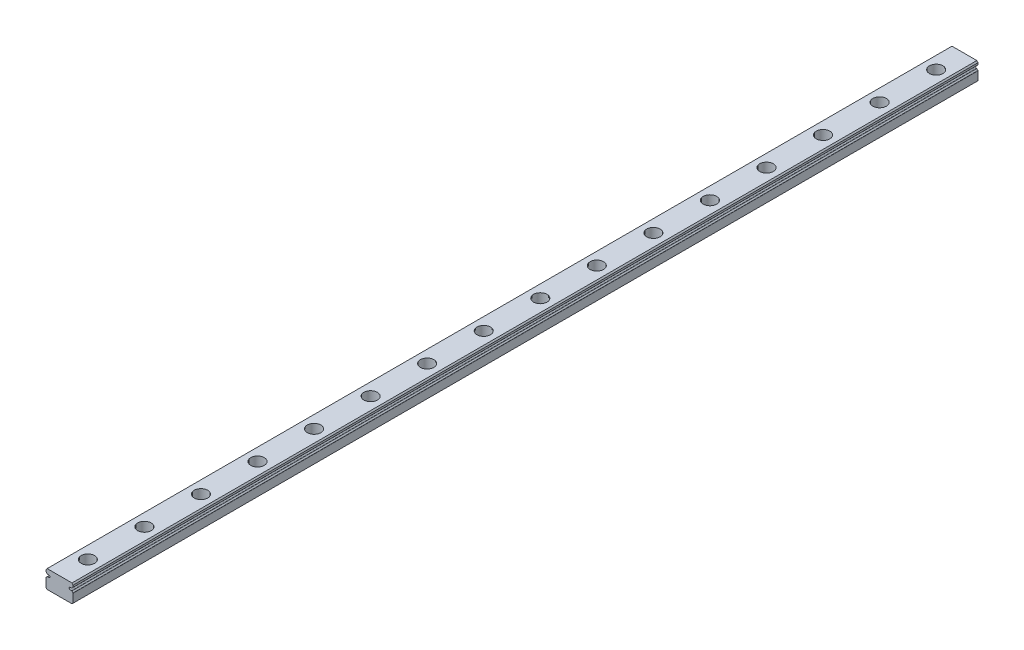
SolidWorks part; units mm, degrees
ref_plane "Aufriss" through (0, 0, 0) normal (0, 0, 1) x (1, 0, 0)
ref_plane "Grundriss" through (0, 0, 0) normal (0, 1, 0) x (1, 0, 0)
ref_plane "Seitenriss" through (0, 0, 0) normal (1, 0, 0) x (0, 0, -1)
sketch "Skizze1" plane through (0, 0, 0) normal (0, 0, 1) x (-1, 0, 0)
  line L28 (4.9194, -4.9806) -> (5.3411, -4.9806)
  line L29 (6, -4.3217) -> (6, -0.5)
  line L30 (6, -0.5) -> (5.5, 0)
  line L31 (5.5, 0) -> (-5.5, 0)
  line L32 (-5.5, 0) -> (-6, -0.5)
  line L33 (-6, -0.5) -> (-6, -4.3217)
  line L34 (-5.3411, -4.9806) -> (-4.9194, -4.9806)
  line L35 (-4.9194, -5.9313) -> (-5.3411, -5.9313)
  line L36 (-6, -6.5901) -> (-6, -7.4119)
  line L37 (-6, -7.4119) -> (-5.5, -8)
  line L38 (-5.5, -8) -> (5.5, -8)
  line L39 (5.5, -8) -> (6, -7.4119)
  line L40 (6, -7.4119) -> (6, -6.5901)
  line L41 (5.3411, -5.9313) -> (4.9194, -5.9313)
  arc A28 (5.3411, -4.9806) -> (5.4807, -4.8988) centre (5.3411, -4.8206) ccw
  arc A29 (5.9182, -4.4613) -> (5.4807, -4.8988) centre (6.4753, -5.4559) ccw
  arc A30 (5.9182, -4.4613) -> (6, -4.3217) centre (5.84, -4.3217) ccw
  arc A31 (-6, -4.3217) -> (-5.9182, -4.4613) centre (-5.84, -4.3217) ccw
  arc A32 (-5.4807, -4.8988) -> (-5.9182, -4.4613) centre (-6.4753, -5.4559) ccw
  arc A33 (-5.4807, -4.8988) -> (-5.3411, -4.9806) centre (-5.3411, -4.8206) ccw
  arc A34 (-4.9194, -5.9313) -> (-4.9194, -4.9806) centre (-4.7642, -5.4559) ccw
  arc A35 (-5.3411, -5.9313) -> (-5.4807, -6.0131) centre (-5.3411, -6.0913) ccw
  arc A36 (-5.9182, -6.4505) -> (-5.4807, -6.0131) centre (-6.4753, -5.4559) ccw
  arc A37 (-5.9182, -6.4505) -> (-6, -6.5901) centre (-5.84, -6.5901) ccw
  arc A38 (6, -6.5901) -> (5.9182, -6.4505) centre (5.84, -6.5901) ccw
  arc A39 (5.4807, -6.0131) -> (5.9182, -6.4505) centre (6.4753, -5.4559) ccw
  arc A40 (5.4807, -6.0131) -> (5.3411, -5.9313) centre (5.3411, -6.0913) ccw
  arc A41 (4.9194, -4.9806) -> (4.9194, -5.9313) centre (4.7642, -5.4559) ccw
extrude "Aufsatz-Linear austragen1" add sketch "Skizze1" against normal blind 4100
hole_wizard "Bohrung1" positions "Skizze3" profile "Skizze2" legacy
sketch "Skizze3" plane through (0, 8, 0) normal (0, 1, 0) x (1, 0, 0)
  line L0 (0, 0) -> (0, 30) construction
  line L1 (5.5, 0) -> (-5.5, 0) construction
  point P0 (0, 30)
  dimension "D1" = 30
sketch "Skizze2" plane through (0, 8, -30) normal (1, 0, 0) x (0, 0, 1)
  line L0 (0, 0) -> (0, 9.0515)
  line L1 (0, 9.0515) -> (1.75, 8)
  line L2 (1.75, 8) -> (1.75, 4.5)
  line L3 (1.75, 4.5) -> (3, 4.5)
  line L4 (3, 0) -> (0, 0)
  line L5 (0, -11.3109) -> (0, 121.1557) construction
  line L6 (0, 9.0515) -> (-1.75, 8) construction
  line L7 (3, 4.5) -> (3, 0)
  dimension "Durchmesser" = 3.5
  dimension "Tiefe" = 8
  dimension "Senkdurchmesser3" = 6
  dimension "Senktiefe1" = 4.5
  dimension "Spitzenwinkel" = 118
pattern_linear "Lineares Muster1" count 163 spacing 25 along (0, 0, -1)
sketch "Skizze4" plane through (0, 8, 0) normal (0, 1, 0) x (1, 0, 0)
  line L0 (6, 4100) -> (6, 0) construction
  line L1 (-6, 4100) -> (6, 4100)
  line L2 (-6, 4100) -> (-6, 517.5)
  line L3 (-6, 517.5) -> (6, 517.5)
  line L4 (6, 4100) -> (6, 517.5)
  line L6 (-6, 0) -> (6, 0)
  line L7 (-6, 0) -> (-6, 17.5)
  line L8 (-6, 17.5) -> (6, 17.5)
  line L9 (6, 0) -> (6, 17.5)
  circle A0 centre (0, 30) radius 3 construction
  dimension "D1" = 12.5
  dimension "D2" = 500
extrude "Schnitt-Linear austragen1" cut sketch "Skizze4" against normal through all
ref_plane "Ebene1" through (0, 0, 0) normal (1, 0, 0) x (0, 0, -1)
equation "\"68x2\"=243"
